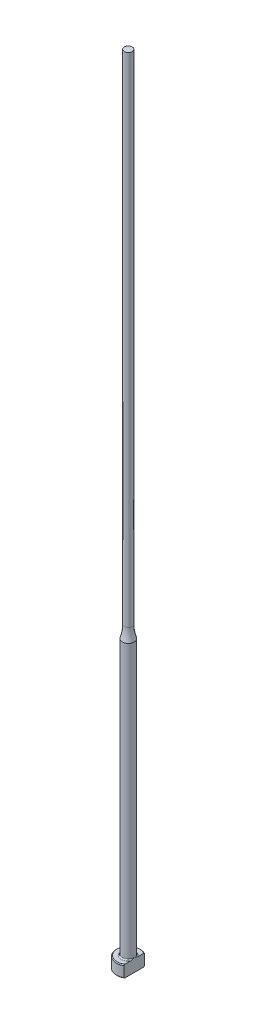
SolidWorks part; units mm, degrees
ref_plane "Front Plane" through (0, 0, 0) normal (0, 0, 1) x (1, 0, 0)
ref_plane "Top Plane" through (0, 0, 0) normal (0, 1, 0) x (1, 0, 0)
ref_plane "Right Plane" through (0, 0, 0) normal (1, 0, 0) x (0, 0, -1)
sketch "Sketch1" plane through (0, 0, 0) normal (0, 0, 1) x (1, 0, 0)
  line L0 (0, 259.9588) -> (0, -15.1925) construction
  line L1 (0, 0) -> (-3, 0)
  line L2 (-3, 0) -> (-3, 3)
  line L3 (-3, 3) -> (-1.5, 3)
  line L4 (-1, 75) -> (-1, 200)
  line L5 (-1, 200) -> (0, 200)
  line L6 (0, 200) -> (0, 0)
  line L7 (-1.5, 3) -> (-1.5, 71.8775)
  arc A0 (-1.5, 71.8775) -> (-1, 75) centre (-11, 75) ccw
  point P13 (-1.5, 0)
  dimension "D1" = 10
  dimension "L" = 200
  dimension "H" = 6
  dimension "T" = 3
  dimension "D" = 2
  dimension "B" = 3
  dimension "S" = 75
revolve "Revolve1" add sketch "Sketch1" angle 360 about L0
chamfer "Chamfer1" distance 0.2 angle 45 2 edges at (0, 3, 3) (0, 0, 3)
fillet "Fillet1" radius 0.3 1 edges at (0, 3, 1.5)
sketch "Sketch2" plane through (0, 0, 0) normal (0, 1, 0) x (1, 0, 0)
  line L0 (1.5, 2.5981) -> (1.5, -2.5981)
  circle A0 centre (0, 0) radius 3 construction
  arc A1 (1.5, -2.5981) -> (1.5, 2.5981) centre (0, 0) ccw
  circle A2 centre (0, 0) radius 1.5 construction
extrude "KEY" cut sketch "Sketch2" along normal through all
